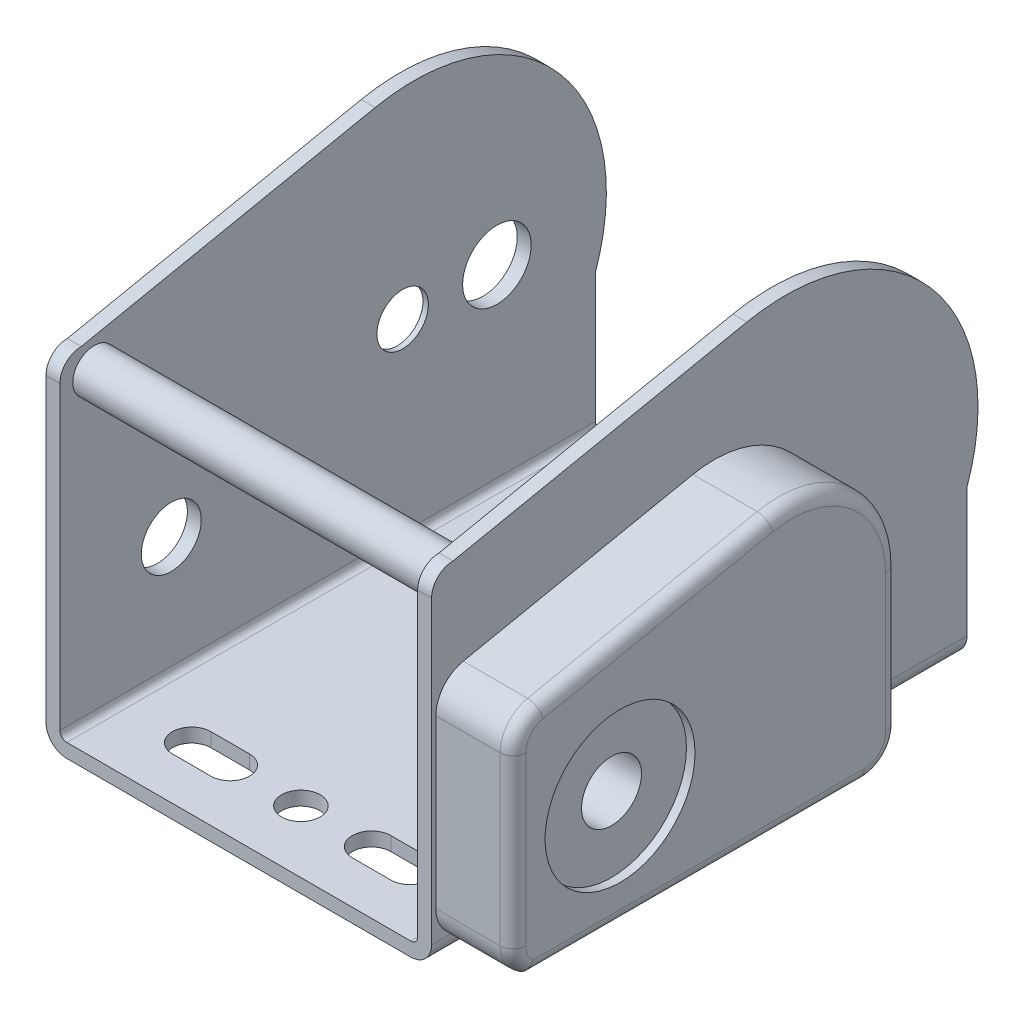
SolidWorks part; units mm, degrees
ref_plane "Plan de face" through (0, 0, 0) normal (0, 0, 1) x (1, 0, 0)
ref_plane "Plan de dessus" through (0, 0, 0) normal (0, 1, 0) x (1, 0, 0)
ref_plane "Plan de droite" through (0, 0, 0) normal (1, 0, 0) x (0, 0, -1)
ref_plane "Plan1" through (0, 0, 0) normal (-1, 0, 0) x (0, -1, 0)
sketch "Esquisse1" plane through (0, 0, 0) normal (-1, 0, 0) x (0, -1, 0)
  line L0 (60, 5) -> (60, 130)
  line L1 (60, 130) -> (20, 130)
  line L2 (15, 125) -> (1, 56.4143)
  arc A0 (1, 56.4143) -> (60, 5) centre (45.0639, 47.4198) ccw
  arc A1 (20, 130) -> (15, 125) centre (20, 125) ccw
extrude "Boss.-Extru.1" add sketch "Esquisse1" against normal blind 3.25
sketch "Esquisse2" plane through (0, -60, 0) normal (0, -1, 0) x (1, 0, 0)
  line L0 (86.75, 5) -> (0, 5)
  line L1 (0, 5) -> (0, 130)
  line L2 (0, 130) -> (86.75, 130)
  line L3 (86.75, 130) -> (86.75, 5)
extrude "Boss.-Extru.2" add sketch "Esquisse2" along normal blind 35
sketch "Esquisse3" plane through (0, -60, 0) normal (0, 1, 0) x (-1, 0, 0)
  line L0 (-3.25, 130) -> (-86.75, 130)
  line L1 (-86.75, 130) -> (-86.75, 5)
  line L2 (-86.75, 5) -> (-3.25, 5)
  line L3 (-3.25, 5) -> (-3.25, 130)
extrude "Enlèv. mat.-Extru.1" cut sketch "Esquisse3" against normal blind 31.75
sketch "Esquisse4" plane through (86.75, 0, 0) normal (1, 0, 0) x (0, 0, -1)
  line L0 (-130, -95) -> (-130, -20)
  line L1 (-125, -15) -> (-56.4143, -1)
  line L2 (-5, -60) -> (-5, -95)
  line L3 (-5, -95) -> (-130, -95)
  arc A0 (-130, -20) -> (-125, -15) centre (-125, -20) cw
  arc A1 (-56.4143, -1) -> (-5, -60) centre (-47.4198, -45.0639) cw
extrude "Boss.-Extru.3" add sketch "Esquisse4" along normal blind 3.25
sketch "Esquisse5" plane through (0, -95, 0) normal (0, -1, 0) x (1, 0, 0)
  line L0 (19.5, 111) -> (28.5, 111)
  line L1 (28.5, 120) -> (19.5, 120)
  arc A0 (19.5, 120) -> (19.5, 111) centre (19.5, 115.5) ccw
  arc A1 (28.5, 111) -> (28.5, 120) centre (28.5, 115.5) ccw
extrude "Enlèv. mat.-Extru.2" cut sketch "Esquisse5" against normal through all
sketch "Esquisse6" plane through (0, -95, 0) normal (0, -1, 0) x (1, 0, 0)
  line L0 (61.5, 111) -> (70.5, 111)
  line L1 (70.5, 120) -> (61.5, 120)
  arc A0 (61.5, 120) -> (61.5, 111) centre (61.5, 115.5) ccw
  arc A1 (70.5, 111) -> (70.5, 120) centre (70.5, 115.5) ccw
extrude "Enlèv. mat.-Extru.3" cut sketch "Esquisse6" against normal through all
sketch "Esquisse7" plane through (0, -95, 0) normal (0, -1, 0) x (1, 0, 0)
  line L0 (40.5, 58.5) -> (40.5, 51.5)
  line L1 (49.5, 51.5) -> (49.5, 58.5)
  arc A0 (49.5, 58.5) -> (40.5, 58.5) centre (45, 58.5) ccw
  arc A1 (40.5, 51.5) -> (49.5, 51.5) centre (45, 51.5) ccw
extrude "Enlèv. mat.-Extru.4" cut sketch "Esquisse7" against normal through all
sketch "Esquisse8" plane through (0, -91.75, 0) normal (0, 1, 0) x (-1, 0, 0)
  line L0 (-49.5, 28.5) -> (-49.5, 16.5)
  line L1 (-40.5, 16.5) -> (-40.5, 28.5)
  arc A0 (-40.5, 28.5) -> (-49.5, 28.5) centre (-45, 28.5) ccw
  arc A1 (-49.5, 16.5) -> (-40.5, 16.5) centre (-45, 16.5) ccw
extrude "Enlèv. mat.-Extru.5" cut sketch "Esquisse8" against normal through all
sketch "Esquisse9" plane through (90, 0, 0) normal (1, 0, 0) x (0, 0, -1)
  line L0 (-129, -83.2863) -> (-129, -19.3831)
  line L1 (-129, -19.3831) -> (-39, -19.3831)
  line L2 (-39, -19.3831) -> (-39, -90)
  line L3 (-39, -90) -> (-125.3504, -90)
  arc A0 (-125.3504, -90) -> (-129, -83.2863) centre (-121, -83.2863) cw
extrude "Boss.-Extru.4" add sketch "Esquisse9" along normal blind 18
draft "Dépouille1" type of draft neutral plane draft angle 11.537 faces to draft 1 parameters "D1"=11.537
ref_plane "Plan2" through (0, 0, 122) normal (0, 0, -1) x (-1, 0, 0)
sketch "Esquisse10" plane through (0, 0, 122) normal (0, 0, -1) x (-1, 0, 0)
  line L0 (-86.75, -16.3246) -> (-86.75, -21.3246)
  line L1 (-86.75, -21.3246) -> (-3.25, -21.3246)
  line L2 (-3.25, -21.3246) -> (-3.25, -16.3246)
  line L3 (-3.25, -16.3246) -> (-86.75, -16.3246)
  line L4 (-86.75, -21.3246) -> (-3.25, -21.3246) construction
revolve "Révolution1" add sketch "Esquisse10" angle 360 about L4
ref_plane "Plan3" through (0, 0, 50) normal (0, 0, -1) x (-1, 0, 0)
sketch "Esquisse11" plane through (0, 0, 50) normal (0, 0, -1) x (-1, 0, 0)
  line L0 (-3.25, -41) -> (-3.25, -47)
  line L1 (-3.25, -47) -> (0, -47)
  line L2 (0, -47) -> (0, -37)
  line L3 (-2, -39) -> (-2, -41)
  line L4 (-2, -41) -> (-3.25, -41)
  line L5 (-3.25, -47) -> (0.0013, -47) construction
  arc A0 (0, -37) -> (-1, -38) centre (-1, -37) cw
  arc A1 (-1, -38) -> (-2, -39) centre (-1, -39) ccw
revolve "Enlèvement de matière-Révolution1" cut sketch "Esquisse11" angle 360 about L5
sketch "Esquisse12" plane through (0, 0, 122) normal (0, 0, -1) x (-1, 0, 0)
  line L0 (-86.75, -18.8246) -> (-86.75, -21.3246)
  line L1 (-86.75, -21.3246) -> (-3.25, -21.3246)
  line L2 (-3.25, -21.3246) -> (-3.25, -18.8246)
  line L3 (-3.25, -18.8246) -> (-86.75, -18.8246)
  line L4 (-86.75, -21.3246) -> (-3.25, -21.3246) construction
revolve "Enlèvement de matière-Révolution2" cut sketch "Esquisse12" angle 360 about L4
hole_wizard "Diamètre du perçage Ø14.0 (14)1" positions "Esquisse14" profile "Esquisse13" hole size "Ø14.0" standard "Ansi Metric"
sketch "Esquisse14" plane through (0, 0, 0) normal (-1, 0, 0) x (0, 0, 1)
  point P0 (104, -64)
sketch "Esquisse13" plane through (0, -64, 104) normal (0, 1, 0) x (0, 0, 1)
  line L0 (0, 0) -> (0, 3.25)
  line L1 (0, 3.25) -> (7, 3.25)
  line L2 (7, 3.25) -> (7, 0)
  line L5 (7, 0) -> (0, 0)
  line L11 (0, -6.35) -> (0, 107.95) construction
  dimension "Diamètre du perçage jusqu'au prochain" = 14
  dimension "Profondeur du perçage jusqu'au prochain" = 3.25
hole_wizard "Diamètre du perçage Ø16.0 (16)1" positions "Esquisse16" profile "Esquisse15" hole size "Ø16.0" standard "Ansi Metric"
sketch "Esquisse16" plane through (0, 0, 0) normal (-1, 0, 0) x (0, 0, 1)
  point P0 (28, -47)
sketch "Esquisse15" plane through (0, -47, 28) normal (0, 1, 0) x (0, 0, 1)
  line L0 (0, 0) -> (0, 3.25)
  line L1 (0, 3.25) -> (8, 3.25)
  line L2 (8, 3.25) -> (8, 0)
  line L5 (8, 0) -> (0, 0)
  line L11 (0, -6.35) -> (0, 107.95) construction
  dimension "Diamètre du perçage jusqu'au prochain" = 16
  dimension "Profondeur du perçage jusqu'au prochain" = 3.25
hole_wizard "Chambrage pour vis à tête hexagonale M121" positions "Esquisse18" profile "Esquisse17" counterbore size "M12" standard "Ansi Metric"
sketch "Esquisse18" plane through (108, 0, 0) normal (1, 0, 0) x (0, 0, -1)
  point P0 (-104, -64)
sketch "Esquisse17" plane through (108, -64, 104) normal (0, 1, 0) x (0, 0, -1)
  line L0 (0, 0) -> (0, 108)
  line L1 (0, 108) -> (7, 108)
  line L3 (7, 108) -> (7, 2)
  line L4 (7, 2) -> (17.5, 2)
  line L5 (17.5, 2) -> (17.5, 0)
  line L7 (17.5, 0) -> (0, 0)
  line L11 (0, -6.35) -> (0, 107.95) construction
  dimension "Diamètre du perçage jusqu'au prochain" = 14
  dimension "Profondeur du perçage jusqu'au prochain" = 108
  dimension "Diamètre du chambrage" = 35
  dimension "Profondeur du chambrage" = 2
hole_wizard "Diamètre du perçage Ø9.0 (9)1" positions "Esquisse20" profile "Esquisse19" hole size "Ø9.0" standard "Ansi Metric"
sketch "Esquisse20" plane through (0, -95, 0) normal (0, -1, 0) x (-1, 0, 0)
  point P0 (-45, -115.5)
sketch "Esquisse19" plane through (45, -95, 115.5) normal (1, 0, 0) x (0, 0, -1)
  line L0 (0, 0) -> (0, 3.25)
  line L1 (0, 3.25) -> (4.5, 3.25)
  line L2 (4.5, 3.25) -> (4.5, 0)
  line L5 (4.5, 0) -> (0, 0)
  line L11 (0, -6.35) -> (0, 107.95) construction
  dimension "Diamètre du perçage jusqu'au prochain" = 9
  dimension "Profondeur du perçage jusqu'au prochain" = 3.25
fillet "Congé1" radius 8 2 edges at (99, -37.7543, 129) (99, -90, 39)
fillet "Congé2" radius 25 1 edges at (99, -19.3831, 39)
fillet "Congé3" radius 1.625 2 edges at (3.25, -91.75, 67.5)
fillet "Congé4" radius 3 8 edges at (108, -90, 86.1752) (108, -87.6569, 41.3431) (108, -66.0009, 39) (108, -30.6369, 48.1886) (108, -30.9774, 95.8) (108, -39.2266, 127.1968) (108, -63.7863, 129) (108, -87.1071, 128.0286)
fillet "Congé5" radius 4.875 2 edges at (90, -95, 67.5) (0, -95, 67.5)
sketch "Esquisse21" plane through (0, -95, 0) normal (0, -1, 0) x (1, 0, 0)
  line L0 (45, 12) -> (45, 33)
  arc A0 (40.5, 16.5) -> (49.5, 16.5) centre (45, 16.5) ccw construction
  arc A1 (49.5, 28.5) -> (40.5, 28.5) centre (45, 28.5) ccw construction
